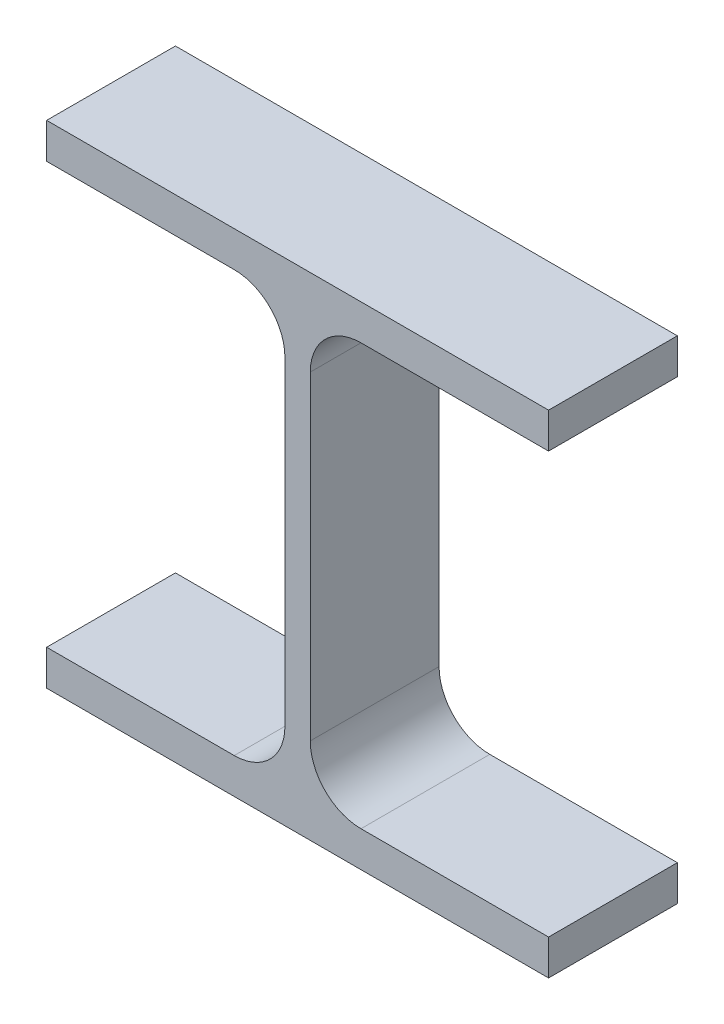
SolidWorks part; units mm, degrees
ref_plane "Front Plane" through (0, 0, 0) normal (0, 0, 1) x (1, 0, 0)
ref_plane "Top Plane" through (0, 0, 0) normal (0, 1, 0) x (1, 0, 0)
ref_plane "Right Plane" through (0, 0, 0) normal (1, 0, 0) x (0, 0, -1)
other "Configuration Table"
sketch "Sketch1" plane through (0, 0, 0) normal (0, 0, 1) x (1, 0, 0)
  line L0 (0, 72.9931) -> (0, -63.9253) construction
  line L1 (-49.5, 48.5) -> (49.5, 48.5)
  line L2 (-49.5, 48.5) -> (-49.5, 41.5)
  line L3 (-49.5, -48.5) -> (49.5, -48.5)
  line L4 (49.5, -41.5) -> (49.5, -48.5)
  line L5 (-42.3074, 0) -> (60.8749, 0) construction
  line L6 (-49.5, -41.5) -> (-49.5, -48.5)
  line L7 (-49.5, 41.5) -> (-12.5, 41.5)
  line L8 (49.5, -41.5) -> (12.5, -41.5)
  line L9 (-49.5, -41.5) -> (-12.5, -41.5)
  line L10 (-2.5, 31.5) -> (-2.5, -31.5)
  line L11 (2.5, 31.5) -> (2.5, -31.5)
  line L12 (49.5, 41.5) -> (12.5, 41.5)
  line L13 (49.5, 48.5) -> (49.5, 41.5)
  arc A0 (-12.5, 41.5) -> (-2.5, 31.5) centre (-12.5, 31.5) cw
  arc A1 (-12.5, -41.5) -> (-2.5, -31.5) centre (-12.5, -31.5) ccw
  arc A2 (12.5, -41.5) -> (2.5, -31.5) centre (12.5, -31.5) cw
  arc A3 (12.5, 41.5) -> (2.5, 31.5) centre (12.5, 31.5) ccw
  point P18 (0, -48.5)
  point P27 (0, 48.5)
  dimension "Radius" = 10
  dimension "Depth" = 97
  dimension "Width" = 99
  dimension "Web_thickness" = 5
  dimension "Thickness" = 7
extrude "BaseSection" add sketch "Sketch1" along normal mid plane 25.4
